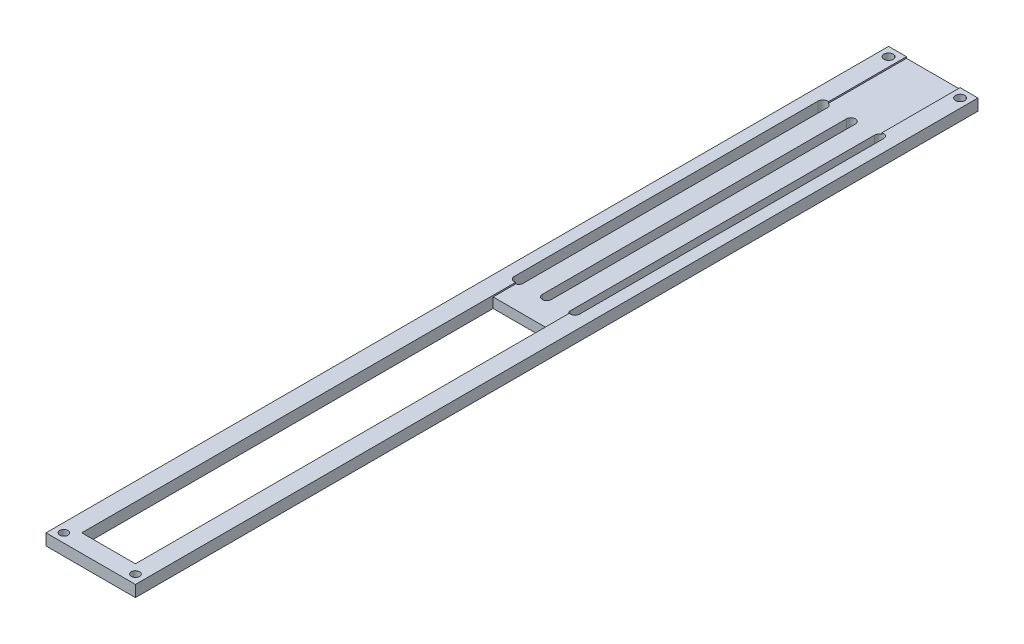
SolidWorks part; units mm, degrees
ref_plane "Front Plane" through (0, 0, 0) normal (0, 0, 1) x (1, 0, 0)
ref_plane "Top Plane" through (0, 0, 0) normal (0, 1, 0) x (1, 0, 0)
ref_plane "Right Plane" through (0, 0, 0) normal (1, 0, 0) x (0, 0, -1)
sketch "Sketch1" plane through (0, 0, 0) normal (0, 0, 1) x (1, 0, 0)
  line L1 (-15.875, 2.032) -> (15.875, 2.032)
  line L2 (-15.875, 2.032) -> (-15.875, -2.032)
  line L3 (-15.875, -2.032) -> (15.875, -2.032)
  line L4 (15.875, 2.032) -> (15.875, -2.032)
  line L5 (-15.875, 2.032) -> (15.875, -2.032) construction
  line L6 (-15.875, -2.032) -> (15.875, 2.032) construction
  point P0 (0, 0)
  dimension "D1" = 4.064
  dimension "D2" = 31.75
extrude "Boss-Extrude1" add sketch "Sketch1" along normal blind 308.6608
sketch "Sketch2" plane through (0, 2.032, 0) normal (0, 1, 0) x (1, 0, 0)
  line L0 (-15.875, -308.6608) -> (-15.875, 0) construction
  line L1 (-9.525, -146.7358) -> (9.525, -146.7358)
  line L2 (-9.525, -146.7358) -> (-9.525, -292.7858)
  line L3 (-9.525, -292.7858) -> (9.525, -292.7858)
  line L4 (9.525, -146.7358) -> (9.525, -292.7858)
  line L6 (15.875, -308.6608) -> (-15.875, -308.6608) construction
  point P8 (0, -308.6608)
  dimension "D1" = 19.05
  dimension "D2" = 6.35
  dimension "D3" = 15.875
  dimension "D4" = 146.05
extrude "Cut-Extrude2" cut sketch "Sketch2" against normal blind 6.35
sketch "Sketch3" plane through (0, 2.032, 0) normal (0, 1, 0) x (1, 0, 0)
  line L1 (-9.525, -146.7358) -> (9.525, -146.7358)
  line L2 (-9.525, -146.7358) -> (-9.525, 7.7978)
  line L3 (-9.525, 7.7978) -> (9.525, 7.7978)
  line L4 (9.525, -146.7358) -> (9.525, 7.7978)
extrude "Cut-Extrude3" cut sketch "Sketch3" against normal blind 0.508
hole_wizard "#4 Clearance Hole1" positions "Sketch4" profile "Sketch5" hole size "#4" standard "ANSI Inch"
sketch "Sketch4" plane through (0, 2.032, 0) normal (0, 1, 0) x (1, 0, 0)
  line L0 (-15.875, -308.6608) -> (-15.875, 0) construction
  line L1 (12.7, -295.9608) -> (-12.7, -295.9608)
  line L3 (15.875, -308.6608) -> (-15.875, -308.6608) construction
  point P0 (12.7, -295.9608)
  point P2 (-12.7, -295.9608)
  dimension "D1" = 25.4
  dimension "D2" = 3.175
  dimension "D3" = 12.7
sketch "Sketch5" plane through (12.7, 2.032, 295.9608) normal (1, 0, 0) x (0, 0, 1)
  line L0 (0, 0) -> (0, 26.2852)
  line L1 (0, 26.2852) -> (1.4732, 25.4)
  line L2 (1.4732, 25.4) -> (1.4732, 0)
  line L5 (1.4732, 0) -> (0, 0)
  line L10 (0, 26.2852) -> (-1.4732, 25.4) construction
  line L11 (0, -6.35) -> (0, 107.95) construction
  dimension "Hole Dia." = 2.9464
  dimension "Hole Depth" = 25.4
  dimension "Drill Angle" = 118
sketch "Sketch6" plane through (0, -2.032, 0) normal (0, -1, 0) x (1, 0, 0)
  line L0 (0.0145, 137.2108) -> (0.0145, 29.2608) construction
  line L1 (1.6145, 137.2108) -> (1.6145, 29.2608)
  line L2 (-1.5855, 137.2108) -> (-1.5855, 29.2608)
  line L3 (-15.875, 0) -> (15.875, 0) construction
  line L5 (-15.875, 308.6608) -> (15.875, 308.6608) construction
  arc A0 (1.6145, 137.2108) -> (-1.5855, 137.2108) centre (0.0145, 137.2108) ccw
  arc A1 (-1.5855, 29.2608) -> (1.6145, 29.2608) centre (0.0145, 29.2608) ccw
  point P2 (0.0145, 83.2358)
  point P11 (0, 0)
  point P12 (0, 0)
  point P13 (0, 0)
  dimension "D1" = 107.95
  dimension "D2" = 29.2608
  dimension "D3" = 171.45
extrude "Cut-Extrude4" cut sketch "Sketch6" against normal blind 8.128
pattern_linear "LPattern1" count 2 spacing 10 along (-1, 0, 0) of "Cut-Extrude4"
pattern_linear "LPattern2" count 2 spacing 10 along (1, 0, 0) of "Cut-Extrude4"
hole_wizard "#4 Clearance Hole2" positions "Sketch7" profile "Sketch8" hole size "#4" standard "ANSI Inch"
sketch "Sketch7" plane through (0, 2.032, 0) normal (0, 1, 0) x (1, 0, 0)
  line L0 (15.875, 0) -> (9.525, 0) construction
  line L1 (-9.525, 0) -> (-15.875, 0) construction
  line L2 (12.7, -306.2795) -> (-12.7, -306.2795)
  line L4 (15.875, -308.6608) -> (-15.875, -308.6608) construction
  point P0 (12.7, -306.2795)
  point P2 (-12.7, -306.2795)
  point P4 (12.7, -3.175)
  point P6 (-12.7, -3.175)
  dimension "D1" = 3.175
  dimension "D2" = 3.175
  dimension "D3" = 25.4
  dimension "D4" = 2.3813
  dimension "D5" = 25.4
  dimension "D6" = 12.7
  dimension "D7" = 12.7
sketch "Sketch8" plane through (12.7, 2.032, 306.2795) normal (1, 0, 0) x (0, 0, 1)
  line L0 (0, 0) -> (0, 26.3806)
  line L1 (0, 26.3806) -> (1.6319, 25.4)
  line L2 (1.6319, 25.4) -> (1.6319, 0)
  line L5 (1.6319, 0) -> (0, 0)
  line L10 (0, 26.3806) -> (-1.632, 25.4) construction
  line L11 (0, -6.35) -> (0, 107.95) construction
  dimension "Hole Dia." = 3.2639
  dimension "Hole Depth" = 25.4
  dimension "Drill Angle" = 118
sketch "Sketch9" plane through (0, 0, 308.6608) normal (0, 0, 1) x (1, 0, 0)
  line L1 (-18.3528, 4.3393) -> (18.3528, 4.3393)
  line L2 (-18.3528, 4.3393) -> (-18.3528, -4.3393)
  line L3 (-18.3528, -4.3393) -> (18.3528, -4.3393)
  line L4 (18.3528, 4.3393) -> (18.3528, -4.3393)
  line L5 (-18.3528, 4.3393) -> (18.3528, -4.3393) construction
  line L6 (-18.3528, -4.3393) -> (18.3528, 4.3393) construction
  point P0 (0, 0)
extrude "Cut-Extrude5" cut sketch "Sketch9" against normal blind 9.525
sketch "Sketch10" plane through (0, 0, 299.1358) normal (0, 0, 1) x (1, 0, 0)
  line L1 (-19.2789, 4.3793) -> (19.2789, 4.3793)
  line L2 (-19.2789, 4.3793) -> (-19.2789, -4.3793)
  line L3 (-19.2789, -4.3793) -> (19.2789, -4.3793)
  line L4 (19.2789, 4.3793) -> (19.2789, -4.3793)
  line L5 (-19.2789, 4.3793) -> (19.2789, -4.3793) construction
  line L6 (-19.2789, -4.3793) -> (19.2789, 4.3793) construction
  point P0 (0, 0)
